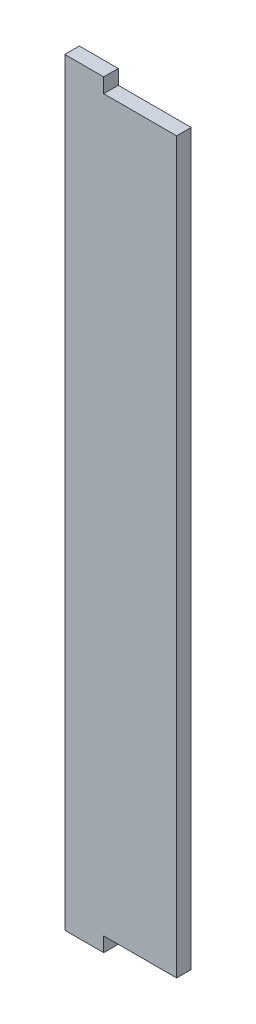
SolidWorks part; units mm, degrees
ref_plane "前视基准面" through (0, 0, 0) normal (0, 0, 1) x (1, 0, 0)
ref_plane "上视基准面" through (0, 0, 0) normal (0, 1, 0) x (1, 0, 0)
ref_plane "右视基准面" through (0, 0, 0) normal (1, 0, 0) x (0, 0, -1)
sketch "草图1" plane through (0, 0, 0) normal (0, 0, 1) x (1, 0, 0)
  line L1 (-11.5, -75) -> (11.5, -75)
  line L2 (-11.5, -75) -> (-11.5, 75)
  line L3 (-11.5, 75) -> (11.5, 75)
  line L4 (11.5, -75) -> (11.5, 75)
  line L5 (-11.5, -75) -> (11.5, 75) construction
  line L6 (-11.5, 75) -> (11.5, -75) construction
  point P0 (0, 0)
  dimension "D1" = 23
  dimension "D2" = 150
extrude "凸台-拉伸1" add sketch "草图1" along normal blind 3
sketch "草图2" plane through (0, 0, 0) normal (0, 0, 1) x (1, 0, 0)
  line L0 (11.5, 75) -> (-11.5, 75) construction
  line L1 (-11.5, 75) -> (-3.5, 75)
  line L2 (-11.5, 75) -> (-11.5, 78)
  line L3 (-11.5, 78) -> (-3.5, 78)
  line L4 (-3.5, 75) -> (-3.5, 78)
  line L7 (-11.5, 0) -> (11.5, 0) construction
  line L8 (-11.5, 75) -> (-11.5, -75) construction
  line L9 (11.5, -75) -> (11.5, 75) construction
  line L10 (-3.5, -75) -> (-3.5, -78)
  line L11 (-11.5, -78) -> (-3.5, -78)
  line L12 (-11.5, -75) -> (-11.5, -78)
  line L13 (-11.5, -75) -> (-3.5, -75)
  point P6 (-12, 75)
  dimension "D1" = 8
  dimension "D2" = 3
extrude "凸台-拉伸2" add sketch "草图2" along normal blind 3
